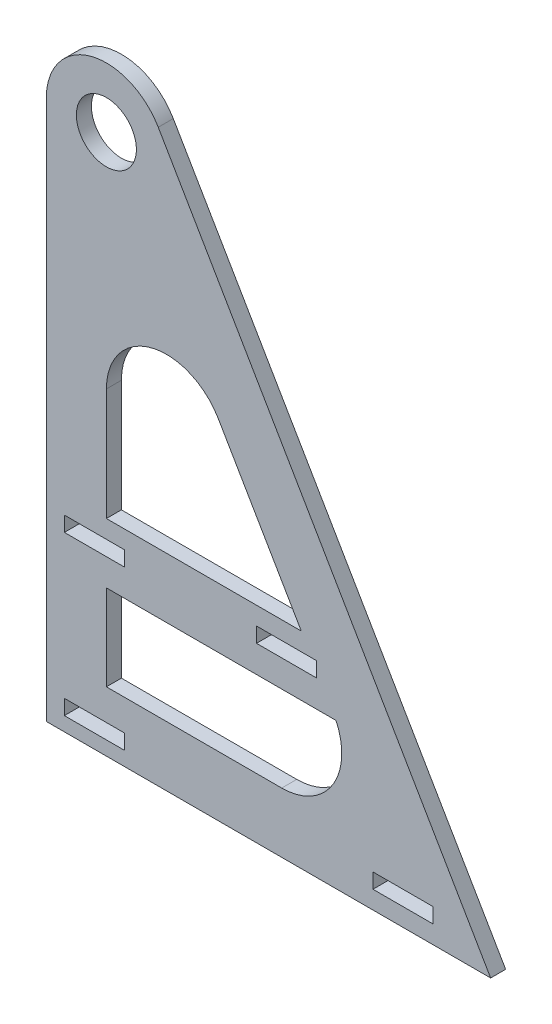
SolidWorks part; units mm, degrees
ref_plane "Front Plane" through (0, 0, 0) normal (0, 0, 1) x (1, 0, 0)
ref_plane "Top Plane" through (0, 0, 0) normal (0, 1, 0) x (1, 0, 0)
ref_plane "Right Plane" through (0, 0, 0) normal (1, 0, 0) x (0, 0, -1)
sketch "Sketch1" plane through (0, 0, 0) normal (0, 0, 1) x (1, 0, 0)
  line L0 (0, 0) -> (0, 71.3699)
  line L1 (0, 0) -> (146.0182, 0)
  line L2 (43.2042, 425.1674) -> (320, -50)
  line L3 (-50, 400) -> (-50, -50)
  line L4 (-50, -50) -> (320, -50)
  line L5 (93.2042, 239.9991) -> (162.3084, 121.3699)
  line L6 (0, 121.3699) -> (162.3084, 121.3699)
  line L7 (0, 71.3699) -> (191.4345, 71.3699)
  line L8 (0, 121.3699) -> (0, 214.8317)
  arc A0 (-50, 400) -> (43.2042, 425.1674) centre (0, 400) cw
  arc A1 (0, 214.8317) -> (93.2042, 239.9991) centre (50, 214.8317) cw
  arc A2 (146.0182, 0) -> (189.2224, 75.1674) centre (146.0182, 50) ccw
  circle A3 centre (0, 400) radius 25
  dimension "D2" = 50
  dimension "D5" = 50
  dimension "D6" = 50
  dimension "D10" = 50
  dimension "D1" = 50
  dimension "D3" = 50
  dimension "D4" = 50
  dimension "D7" = 450
  dimension "D8" = 370
  dimension "D9" = 50
extrude "Boss-Extrude1" add sketch "Sketch1" along normal blind 12.5
sketch "Sketch3" plane through (0, 0, 12.5) normal (0, 0, 1) x (1, 0, 0)
  line L1 (175, 106.3699) -> (125, 106.3699)
  line L2 (175, 106.3699) -> (175, 93.8699)
  line L3 (175, 93.8699) -> (125, 93.8699)
  line L4 (125, 106.3699) -> (125, 93.8699)
  line L5 (15, 106.3699) -> (-35, 106.3699)
  line L6 (15, 106.3699) -> (15, 93.8699)
  line L7 (15, 93.8699) -> (-35, 93.8699)
  line L8 (-35, 106.3699) -> (-35, 93.8699)
  line L9 (-50, 400) -> (-50, -50) construction
  line L10 (0, 121.3699) -> (162.3084, 121.3699) construction
  dimension "D1" = 12.5
  dimension "D2" = 12.5
  dimension "D3" = 50
  dimension "D4" = 50
  dimension "D5" = 15
  dimension "D6" = 110
  dimension "D7" = 15
  dimension "D8" = 15
extrude "Cut-Extrude2" cut sketch "Sketch3" against normal blind 12.5
sketch "Sketch4" plane through (0, 0, 0) normal (0, 0, -1) x (-1, 0, 0)
  line L0 (50, -50) -> (-320, -50) construction
  line L1 (-272, -22.5) -> (-222, -22.5)
  line L2 (-272, -22.5) -> (-272, -35)
  line L3 (-272, -35) -> (-222, -35)
  line L4 (-222, -22.5) -> (-222, -35)
  line L5 (50, 400) -> (50, -50) construction
  dimension "D1" = 50
  dimension "D2" = 12.5
  dimension "D3" = 15
  dimension "D4" = 272
extrude "Cut-Extrude3" cut sketch "Sketch4" against normal blind 12.5
sketch "Sketch6" plane through (0, 0, 0) normal (0, 0, -1) x (-1, 0, 0)
  line L0 (50, 400) -> (50, -50) construction
  line L1 (35, -25.7737) -> (-15, -25.7737)
  line L2 (35, -25.7737) -> (35, -38.2737)
  line L3 (35, -38.2737) -> (-15, -38.2737)
  line L4 (-15, -25.7737) -> (-15, -38.2737)
  dimension "D1" = 12.5
  dimension "D2" = 50
  dimension "D3" = 15
extrude "Cut-Extrude4" cut sketch "Sketch6" against normal blind 12.5
